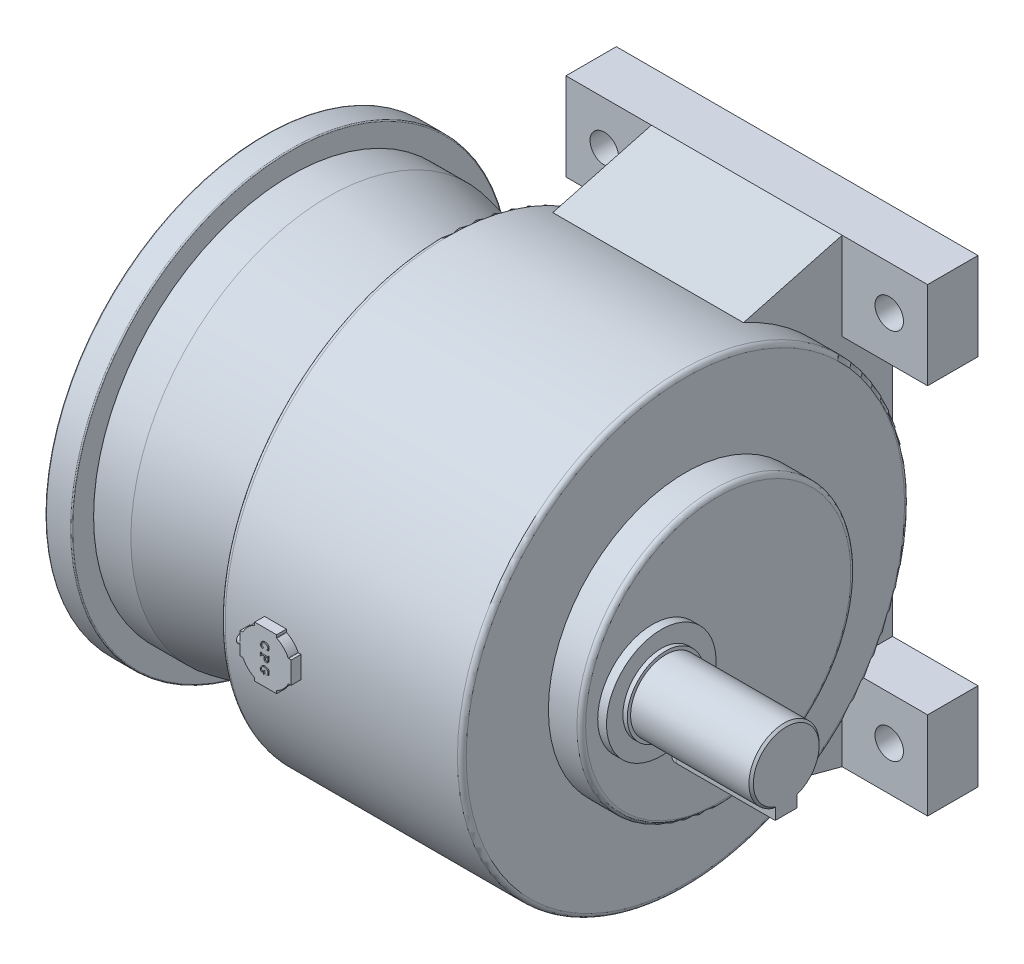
SolidWorks part; units mm, degrees
ref_plane "前视基准面" through (0, 0, 0) normal (0, 0, 1) x (1, 0, 0)
ref_plane "上视基准面" through (0, 0, 0) normal (0, 1, 0) x (1, 0, 0)
ref_plane "右视基准面" through (0, 0, 0) normal (1, 0, 0) x (0, 0, -1)
ref_plane "基准面1" through (0, 0, -140) normal (0, 0, 1) x (1, 0, 0)
sketch "草图1" plane through (0, 0, 0) normal (0, 1, 0) x (1, 0, 0)
  line L0 (0, 0) -> (33.1729, 0) construction
  line L1 (0, 0) -> (0, -16)
  line L2 (0, -16) -> (-55, -16)
  line L3 (-55, -16) -> (-55, -17.5)
  line L4 (-55, -17.5) -> (-57, -17.5)
  line L5 (-57, -17.5) -> (-57, -25)
  line L6 (-57, -25) -> (-61, -25)
  line L7 (-61, -25) -> (-61, 0)
  line L8 (-61, 0) -> (0, 0)
  dimension "D1" = 55
  dimension "D2" = 32
  dimension "D3" = 35
  dimension "D4" = 2
  dimension "D5" = 50
  dimension "D6" = 4
revolve "旋转1" add sketch "草图1" angle 360 about L0
sketch "草图2" plane through (0, 0, 0) normal (0, 1, 0) x (1, 0, 0)
  line L0 (8.0167, 30) -> (-61, 30) construction
  line L1 (-61, 30) -> (-61, -32.5)
  line L2 (-61, 25) -> (-61, -25) construction
  line L3 (-61, -32.5) -> (-76, -32.5)
  line L4 (-76, -32.5) -> (-76, -72)
  line L5 (-76, -72) -> (-186, -72)
  line L6 (-186, -72) -> (-186, 30)
  line L11 (-61, 30) -> (-186, 30)
  line L13 (-103.125, 140) -> (103.125, 140) construction
  dimension "D1" = 30
  dimension "D2" = 125
  dimension "D3" = 15
  dimension "D4" = 212
  dimension "D5" = 110
revolve "旋转2" add sketch "草图2" angle 360 about L0
sketch "草图3" plane through (0, 0, -140) normal (0, 0, 1) x (1, 0, 0)
  line L0 (0, 0) -> (40.0459, 0) construction
  line L1 (-217.5, -65) -> (-52.5, -65)
  line L2 (-217.5, -65) -> (-217.5, -105)
  line L3 (-217.5, -105) -> (-52.5, -105)
  line L4 (-52.5, -65) -> (-52.5, -105)
  line L5 (0, -16) -> (0, 16) construction
  circle A0 centre (-70, -85) radius 6.5
  circle A1 centre (-200, -85) radius 6.5
  dimension "D2" = 170
  dimension "D3" = 13
  dimension "D4" = 130
  dimension "D6" = 70
  dimension "D8" = 40
  dimension "D1" = 210
  dimension "D5" = 165
  dimension "D7" = 17.5
extrude "拉伸2" add sketch "草图3" along normal blind 23
mirror "镜向2" about plane through (0, 0, 0) normal (0, 1, 0)
ref_plane "基准面4" through (-135, 0, 0) normal (1, 0, 0) x (0, 0, -1)
sketch "草图4" plane through (-135, 0, 0) normal (1, 0, 0) x (0, 0, -1)
  line L0 (117, 65) -> (140, 65) construction
  line L1 (117, 65) -> (140, 65)
  line L2 (117, 105) -> (117, 65) construction
  line L3 (117, 105) -> (117, 65)
  line L4 (117, -65) -> (140, -65) construction
  line L5 (117, -65) -> (140, -65)
  line L6 (117, -105) -> (117, -65) construction
  line L7 (117, -105) -> (117, -65)
  line L8 (140, 65) -> (140, -65)
  line L9 (117, 105) -> (72, 92.9516)
  line L11 (72, -92.9516) -> (117, -105)
  arc A1 (72, -92.9516) -> (72, 92.9516) centre (30, 0) ccw
  circle A2 centre (30, 0) radius 102 construction
  dimension "D1" = 45
extrude "拉伸3" add sketch "草图4" against normal mid plane 87
sketch "草图5" plane through (0, 0, 0) normal (0, 1, 0) x (1, 0, 0)
  line L0 (0, -5) -> (-45, -5)
  line L1 (0, -16) -> (0, 16) construction
  line L2 (-45, 5) -> (0, 5)
  line L3 (0, 5) -> (0, -5)
  line L4 (35.5, -13.7955) -> (35.5, 19.6443) construction
  arc A0 (-45, -5) -> (-45, 5) centre (-45, 0) cw
  dimension "D2" = 50
  dimension "D1" = 10
  dimension "D3" = 35.5
extrude "拉伸4" add sketch "草图5" against normal blind 19.5
fillet "圆角1" radius 2 3 edges at (-186, 0, -132) (-76, 0, -132) (-61, 0, -92.5)
chamfer "倒角1" distance 1 angle 45 1 edges at (0, 16, 0)
sketch "草圖1" plane through (0, 0, 0) normal (0, 1, 0) x (1, 0, 0)
  line L0 (-254.4998, 30) -> (-186, 30)
  line L1 (-267.4998, 130) -> (-256.4998, 130)
  line L2 (-255.9998, 129.5) -> (-255.9998, 120.0026)
  line L3 (-255.9475, 120) -> (-238.9998, 120)
  line L4 (-238.9998, 120) -> (-198, 111.5)
  line L5 (-226.9998, 77.375) -> (-226.9998, 78.1207)
  line L6 (-267.9998, 129.5) -> (-267.9998, 95)
  line L7 (-253.9998, 71) -> (-228.9998, 71)
  line L8 (-255.9998, 69) -> (-255.9998, 56)
  line L9 (-293.0981, 30) -> (-164.7865, 30) construction
  line L10 (-267.9998, 95) -> (-263.6998, 95)
  line L11 (-228.3496, 83.0029) -> (-263.6998, 95)
  line L12 (-254.4998, 56) -> (-254.4998, 30)
  line L13 (-225.6838, 80.0001) -> (-225.6838, 80.0215)
  line L14 (-255.9998, 56) -> (-254.4998, 56)
  line L15 (-186, 111.5) -> (-186, 30)
  line L16 (-198, 111.5) -> (-186, 111.5)
  line L17 (0, -5) -> (0, 5) construction
  arc A0 (-225.6838, 80.0001) -> (-226.9998, 78.1207) centre (-224.9998, 78.1207) ccw
  arc A1 (-228.9998, 71) -> (-226.9998, 77.375) centre (-236.8093, 76.9513) ccw
  arc A2 (-253.9998, 71) -> (-255.9998, 69) centre (-253.9998, 69) ccw
  arc A6 (-225.6838, 80.0215) -> (-228.3496, 83.0029) centre (-228.6838, 80.0215) ccw
  arc A7 (-255.9998, 120.0026) -> (-255.9475, 120) centre (-255.9475, 120.5232) ccw
  arc A8 (-267.4998, 130) -> (-267.9998, 129.5) centre (-267.4998, 129.5) ccw
  arc A9 (-255.9998, 129.5) -> (-256.4998, 130) centre (-256.4998, 129.5) ccw
  point P9 (0, 0)
  dimension "D1" = 200
  dimension "D2" = 130
  dimension "D6" = 81.9998
  dimension "D12" = 180
  dimension "D13" = 163
  dimension "D14" = 30
revolve "旋轉1" add sketch "草圖1" angle 360 about L9
sketch "草圖2" plane through (-267.9998, 0, 0) normal (-1, 0, 0) x (0, 0, 1)
  line L0 (-30, 0) -> (-30, 120.5316) construction
  circle A0 centre (-30, 0) radius 82.5 construction
  circle A1 centre (-88.3363, 58.3363) radius 5
  circle A2 centre (28.3363, 58.3363) radius 5
  circle A3 centre (28.3363, -58.3363) radius 5
  circle A4 centre (-88.3363, -58.3363) radius 5
  dimension "D1" = 165
  dimension "D2" = 10
extrude "伸長1" cut sketch "草圖2" against normal blind 25
sketch "草圖3" plane through (-267.9998, 0, 0) normal (-1, 0, 0) x (0, 0, 1)
  line L30 (16.1366, -59.1698) -> (23.033, -53.033)
  line L31 (-30, 0) -> (-120.6873, 90.6873) construction
  line L32 (-2.5946, -49.5204) -> (4.6515, -58.2893)
  line L33 (-76.1366, 59.1698) -> (-83.033, 53.033)
  line L34 (22.4023, 23.0903) -> (40.6304, 31.1223)
  line L35 (19.5204, -27.4054) -> (28.2893, -34.6515)
  line L36 (-82.4023, -23.0903) -> (-100.6304, -31.1223)
  line L37 (-6.9097, 52.4023) -> (1.1223, 70.6304)
  line L38 (-53.0903, -52.4023) -> (-61.1223, -70.6304)
  line L39 (-76.1366, -59.1698) -> (-83.033, -53.033)
  line L40 (-30, 0) -> (-114.5, 0) construction
  line L41 (-30, 0) -> (54.5, 0) construction
  line L42 (-57.4054, 49.5204) -> (-64.6515, 58.2893)
  line L43 (-53.0903, 52.4023) -> (-61.1223, 70.6304)
  line L44 (-79.5204, 27.4054) -> (-88.2893, 34.6515)
  line L45 (-6.9097, -52.4023) -> (1.1223, -70.6304)
  line L46 (-30, 0) -> (-30, 84.5) construction
  line L47 (29.1698, 46.1366) -> (23.033, 53.033)
  line L48 (-2.5946, 49.5204) -> (4.6515, 58.2893)
  line L49 (-82.4023, 23.0903) -> (-100.6304, 31.1223)
  line L50 (-89.1698, 46.1366) -> (-83.033, 53.033)
  line L51 (19.5204, 27.4054) -> (28.2893, 34.6515)
  line L52 (-30, 0) -> (-30, -84.5) construction
  line L53 (29.1698, -46.1366) -> (23.033, -53.033)
  line L54 (-57.4054, -49.5204) -> (-64.6515, -58.2893)
  line L55 (16.1366, 59.1698) -> (23.033, 53.033)
  line L56 (-79.5204, -27.4054) -> (-88.2893, -34.6515)
  line L57 (-89.1698, -46.1366) -> (-83.033, -53.033)
  line L58 (22.4023, -23.0903) -> (40.6304, -31.1223)
  arc A48 (-82.4023, 23.0903) -> (-79.5308, 23.9103) centre (-81.3319, 24.7798) ccw
  arc A50 (-76.1366, 59.1698) -> (-64.6515, 58.2893) centre (-70.8184, 53.1934) cw
  arc A51 (-3.051, -80.0874) -> (1.1223, -70.6304) centre (-5.2834, -73.453) ccw
  arc A52 (-54.9562, -49.0121) -> (-57.4054, -49.5204) centre (-55.8637, -50.7944) ccw
  arc A53 (50.0874, 26.949) -> (40.6304, 31.1223) centre (43.453, 24.7166) ccw
  arc A54 (-56.949, 80.0874) -> (-30, 84.5) centre (-30, 0) cw
  arc A55 (-3.051, 80.0874) -> (-30, 84.5) centre (-30, 0) ccw
  arc A56 (50.0874, -26.949) -> (40.6304, -31.1223) centre (43.453, -24.7166) cw
  arc A57 (-89.1698, 46.1366) -> (-88.2893, 34.6515) centre (-83.1934, 40.8184) ccw
  arc A58 (-79.0121, 24.9562) -> (-79.5308, 23.9103) centre (-30, 0) ccw
  arc A59 (-110.0874, 26.949) -> (-114.5, 0) centre (-30, 0) ccw
  arc A60 (-5.0438, -49.0121) -> (-6.0897, -49.5308) centre (-30, 0) cw
  arc A61 (-79.0121, -24.9562) -> (-79.5204, -27.4054) centre (-80.7944, -25.8637) cw
  arc A62 (-76.1366, -59.1698) -> (-64.6515, -58.2893) centre (-70.8184, -53.1934) ccw
  arc A63 (-56.949, -80.0874) -> (-30, -84.5) centre (-30, 0) ccw
  arc A64 (-53.0903, 52.4023) -> (-53.9103, 49.5308) centre (-54.7798, 51.3319) cw
  arc A65 (16.1366, 59.1698) -> (4.6515, 58.2893) centre (10.8184, 53.1934) ccw
  arc A66 (-6.9097, 52.4023) -> (-6.0897, 49.5308) centre (-5.2202, 51.3319) ccw
  arc A67 (-79.0121, -24.9562) -> (-79.5308, -23.9103) centre (-30, 0) cw
  arc A68 (-54.9562, 49.0121) -> (-57.4054, 49.5204) centre (-55.8637, 50.7944) cw
  arc A69 (-5.0438, 49.0121) -> (-6.0897, 49.5308) centre (-30, 0) ccw
  arc A70 (19.0121, 24.9562) -> (19.5308, 23.9103) centre (-30, 0) cw
  arc A71 (-56.949, 80.0874) -> (-61.1223, 70.6304) centre (-54.7166, 73.453) ccw
  arc A72 (50.0874, 26.949) -> (54.5, 0) centre (-30, 0) cw
  arc A73 (-5.0438, -49.0121) -> (-2.5946, -49.5204) centre (-4.1363, -50.7944) cw
  arc A74 (-89.1698, -46.1366) -> (-88.2893, -34.6515) centre (-83.1934, -40.8184) cw
  arc A75 (19.0121, -24.9562) -> (19.5204, -27.4054) centre (20.7944, -25.8637) ccw
  arc A76 (-5.0438, 49.0121) -> (-2.5946, 49.5204) centre (-4.1363, 50.7944) ccw
  arc A77 (19.0121, 24.9562) -> (19.5204, 27.4054) centre (20.7944, 25.8637) cw
  arc A78 (29.1698, 46.1366) -> (28.2893, 34.6515) centre (23.1934, 40.8184) cw
  arc A79 (-3.051, 80.0874) -> (1.1223, 70.6304) centre (-5.2834, 73.453) cw
  arc A80 (-54.9562, 49.0121) -> (-53.9103, 49.5308) centre (-30, 0) cw
  arc A81 (22.4023, 23.0903) -> (19.5308, 23.9103) centre (21.3319, 24.7798) cw
  arc A82 (29.1698, -46.1366) -> (28.2893, -34.6515) centre (23.1934, -40.8184) ccw
  arc A83 (-6.9097, -52.4023) -> (-6.0897, -49.5308) centre (-5.2202, -51.3319) cw
  arc A84 (-110.0874, -26.949) -> (-100.6304, -31.1223) centre (-103.453, -24.7166) ccw
  arc A85 (-110.0874, 26.949) -> (-100.6304, 31.1223) centre (-103.453, 24.7166) cw
  arc A86 (50.0874, -26.949) -> (54.5, 0) centre (-30, 0) ccw
  arc A87 (-79.0121, 24.9562) -> (-79.5204, 27.4054) centre (-80.7944, 25.8637) ccw
  arc A88 (19.0121, -24.9562) -> (19.5308, -23.9103) centre (-30, 0) ccw
  arc A89 (16.1366, -59.1698) -> (4.6515, -58.2893) centre (10.8184, -53.1934) cw
  arc A90 (-54.9562, -49.0121) -> (-53.9103, -49.5308) centre (-30, 0) ccw
  arc A91 (-82.4023, -23.0903) -> (-79.5308, -23.9103) centre (-81.3319, -24.7798) cw
  arc A92 (22.4023, -23.0903) -> (19.5308, -23.9103) centre (21.3319, -24.7798) ccw
  arc A93 (-3.051, -80.0874) -> (-30, -84.5) centre (-30, 0) cw
  arc A94 (-56.949, -80.0874) -> (-61.1223, -70.6304) centre (-54.7166, -73.453) cw
  arc A95 (-53.0903, -52.4023) -> (-53.9103, -49.5308) centre (-54.7798, -51.3319) ccw
  arc A96 (-110.0874, -26.949) -> (-114.5, 0) centre (-30, 0) cw
  circle A97 centre (-30, 0) radius 50
  point P145 (-69.9374, 64.6861)
  point P174 (34.6861, 39.9374)
  point P202 (9.9374, -64.6861)
  point P229 (-94.6861, -39.9374)
extrude "伸長2" cut sketch "草圖3" against normal blind 55 draft 2
sketch "草圖4" plane through (-212.9998, 0, 0) normal (-1, 0, 0) x (0, 0, 1)
  circle A0 centre (-30, 0) radius 66.5 construction
  circle A1 centre (-77.0226, 47.0226) radius 3.5
  circle A2 centre (17.0226, 47.0226) radius 3.5
  circle A3 centre (17.0226, -47.0226) radius 3.5
  circle A4 centre (-77.0226, -47.0226) radius 3.5
  dimension "D1" = 133
  dimension "D2" = 7
extrude "伸長3" cut sketch "草圖4" against normal blind 11
sketch "草圖6" plane through (-254.4998, 0, 0) normal (-1, 0, 0) x (0, 0, 1)
  line L0 (-7.5, 0) -> (-52.5, 0) construction
  line L1 (-30, -22.5) -> (-30, 22.5) construction
  line L2 (-18.6863, -4) -> (-14.7, -4)
  line L3 (-18.6863, 4) -> (-14.7, 4)
  line L4 (-14.7, 4) -> (-14.7, -4)
  arc A0 (-18.6863, 4) -> (-18.6863, -4) centre (-30, 0) ccw
  circle A1 centre (-30, 0) radius 19.75 construction
  dimension "D1" = 12
  dimension "D2" = 8
  dimension "D3" = 15.3
extrude "伸長4" cut sketch "草圖6" against normal blind 46 contours L3 A0 L2 L4
sketch "草圖7" plane through (-254.4998, 0, 0) normal (-1, 0, 0) x (0, 0, 1)
  line L0 (-18.6863, 4) -> (-14.7, 4) construction
  line L1 (-14.7, 4) -> (-14.7, -4) construction
  line L2 (-18.6863, -4) -> (-14.7, -4) construction
  line L3 (-18.6863, 4) -> (-14.7, 4)
  line L4 (-14.7, 4) -> (-14.7, -4)
  line L5 (-18.6863, -4) -> (-14.7, -4)
  circle A0 centre (-30, 0) radius 19.75 construction
  circle A1 centre (-30, 0) radius 19.75
  arc A2 (-18.6863, 4) -> (-18.6863, -4) centre (-30, 0) ccw construction
  arc A3 (-18.6863, 4) -> (-18.6863, -4) centre (-30, 0) ccw
extrude "伸長5" add sketch "草圖7" along normal blind 1
ref_plane "平面1" through (0, 0, 76.5) normal (0, 0, 1) x (1, 0, 0)
sketch "草圖8" plane through (0, 0, 76.5) normal (0, 0, 1) x (1, 0, 0)
  line L0 (-166, 11.65) -> (-156, 11.65)
  line L1 (-166, 11.65) -> (-166, 10.5119)
  line L2 (-156, 11.65) -> (-156, 10.5119)
  line L3 (-166, -10.5119) -> (-166, -11.65)
  line L4 (-156, -10.5119) -> (-156, -11.65)
  line L5 (-172.65, 5) -> (-171.5119, 5)
  line L6 (-172.65, -5) -> (-171.5119, -5)
  line L7 (-172.65, -5) -> (-172.65, 5)
  line L8 (-166, -11.65) -> (-166, -10.5119)
  line L9 (-156, -11.65) -> (-156, -10.5119)
  line L10 (-156, -11.65) -> (-166, -11.65)
  line L11 (-149.35, -5) -> (-150.4881, -5)
  line L12 (-149.35, 5) -> (-150.4881, 5)
  line L13 (-149.35, 5) -> (-149.35, -5)
  arc A0 (-166.1383, 10.2882) -> (-171.2882, 5.1383) centre (-161, 0) ccw
  arc A1 (-166.1383, 10.2882) -> (-166, 10.5119) centre (-166.25, 10.5119) ccw
  arc A2 (-156, 10.5119) -> (-155.8617, 10.2882) centre (-155.75, 10.5119) ccw
  arc A3 (-171.5119, 5) -> (-171.2882, 5.1383) centre (-171.5119, 5.25) ccw
  arc A4 (-171.2882, -5.1383) -> (-171.5119, -5) centre (-171.5119, -5.25) ccw
  arc A5 (-166, -10.5119) -> (-166.1383, -10.2882) centre (-166.25, -10.5119) ccw
  arc A6 (-155.8617, -10.2882) -> (-156, -10.5119) centre (-155.75, -10.5119) ccw
  arc A7 (-150.4881, -5) -> (-150.7118, -5.1383) centre (-150.4881, -5.25) ccw
  arc A8 (-150.7118, 5.1383) -> (-150.4881, 5) centre (-150.4881, 5.25) ccw
  arc A9 (-150.7118, 5.1383) -> (-155.8617, 10.2882) centre (-161, 0) ccw
  arc A10 (-171.2882, -5.1383) -> (-166.1383, -10.2882) centre (-161, 0) ccw
  arc A11 (-155.8617, -10.2882) -> (-150.7118, -5.1383) centre (-161, 0) ccw
  dimension "D1" = 11.5
extrude "伸長6" add sketch "草圖8" against normal blind 4.5 separate body contours A6 A11 A7 L11 L13 L12 A8 A9 A2 L2 L0 L1 A1 A0 A3 L5 L7 L6 A4 A10 A5 L3 L10 L4
sketch "草圖9"
extrude "伸長7" add sketch "草圖9" along normal blind 0.5
sketch "草圖10" plane through (0, 0, 0) normal (0, 1, 0) x (1, 0, 0)
  line L0 (-174.5404, -74.25) -> (-166.5404, -74.25)
  line L1 (-174.5404, -74.25) -> (-174.5404, -72.25)
  line L2 (-173.0404, -73) -> (-173.0404, -72.25)
  line L13 (-171.0404, -73) -> (-166.5404, -73.25)
  line L15 (-173.0404, -73) -> (-171.0404, -73)
  line L23 (-174.5404, -72.25) -> (-173.0404, -72.25)
  line L24 (-171.0404, -74.25) -> (-171.0404, -73)
  line L25 (-166.5404, -74.25) -> (-166.5404, -73.25)
revolve "旋轉2" add sketch "草圖10" angle 360 about L0
equation "\"D5@草图2\"=\"D4@草图3\"-20"
equation "\"D7@草图3\"=(\"D5@草图3\"-\"D4@草图3\")/2"
equation "\"D8@草图3\" = \"D1@草图3\"-\"D2@草图3\""
equation "\"D1@拉伸4\" = \"D3@草图5\"-\"D2@草图1\"/2"
equation "\"D3@草图1\"=\"D2@草图1\"+3"
equation "\"D1@基准面4\" = \"D5@草图3\"/2"
equation "\"D1@拉伸3\" = \"D4@草图3\"-\"D3@草图3\"-30"
